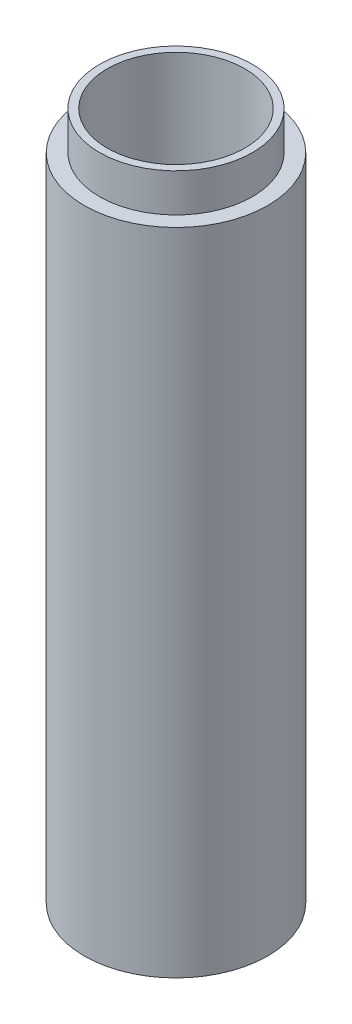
SolidWorks part; units mm, degrees
ref_plane "前视基准面" through (0, 0, 0) normal (0, 0, 1) x (1, 0, 0)
ref_plane "上视基准面" through (0, 0, 0) normal (0, 1, 0) x (1, 0, 0)
ref_plane "右视基准面" through (0, 0, 0) normal (1, 0, 0) x (0, 0, -1)
sketch "草图1" plane through (0, 0, 0) normal (0, 1, 0) x (1, 0, 0)
  circle A0 centre (0, 0) radius 12
  circle A1 centre (0, 0) radius 9
  dimension "D1" = 24
  dimension "D2" = 18
extrude "凸台-拉伸1" add sketch "草图1" along normal mid plane 90
sketch "草图2" plane through (0, 45, 0) normal (0, 1, 0) x (1, 0, 0)
  circle A0 centre (0, 0) radius 10
  circle A1 centre (0, 0) radius 12 construction
  circle A2 centre (0, 0) radius 12
  dimension "D1" = 20
extrude "切除-拉伸1" cut sketch "草图2" against normal blind 5
